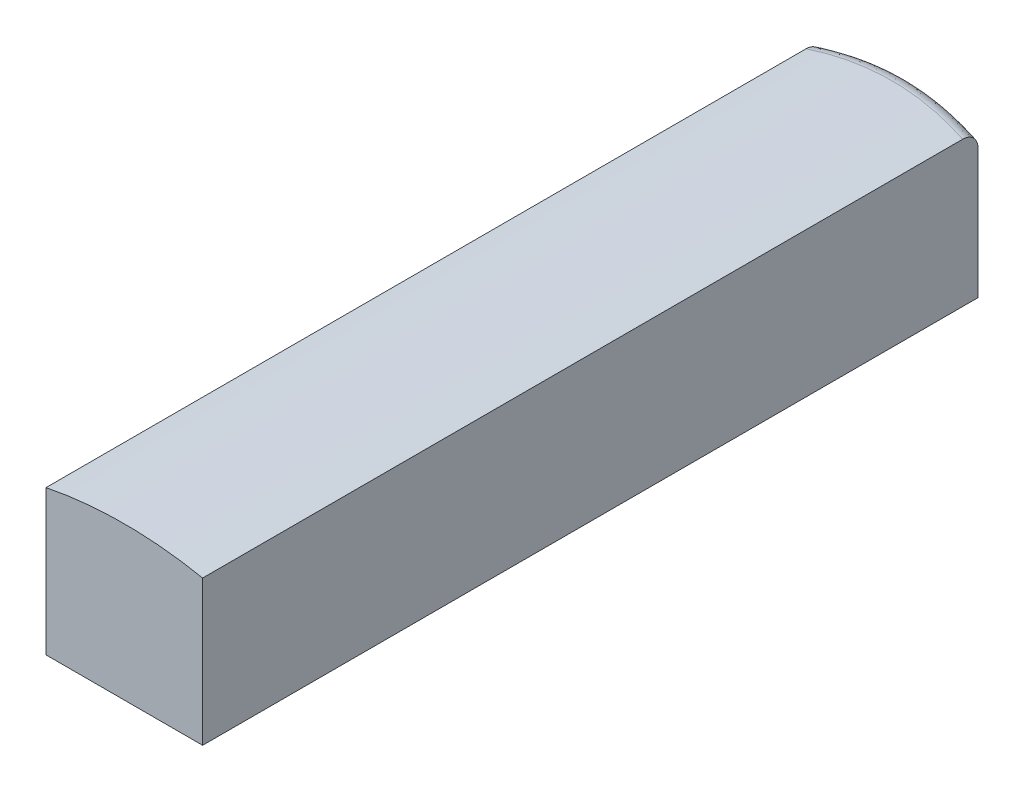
SolidWorks part; units mm, degrees
ref_plane "Vorne" through (0, 0, 0) normal (0, 0, 1) x (1, 0, 0)
ref_plane "Oben" through (0, 0, 0) normal (0, 1, 0) x (1, 0, 0)
ref_plane "Rechts" through (0, 0, 0) normal (1, 0, 0) x (0, 0, -1)
sketch "Skizze1" plane through (0, 0, 0) normal (0, 0, 1) x (1, 0, 0)
  line L0 (100, 0) -> (100, 180) construction
  line L1 (-100, 0) -> (100, 0) construction
  line L2 (-100, 180) -> (-100, 0) construction
  line L3 (100, 0) -> (100, 185)
  line L4 (-100, 0) -> (100, 0)
  line L5 (-100, 185) -> (-100, 0)
  line L6 (100, 200) -> (-100, 200) construction
  arc A0 (-100, 185) -> (100, 185) centre (0, -310) cw
  dimension "D1" = 5
  dimension "D2" = 15
extrude "Linear austragen1" add sketch "Skizze1" against normal up to surface (990 mm away)
fillet "Verrundung1" radius 20 1 edges at (0, 195, -1000)
